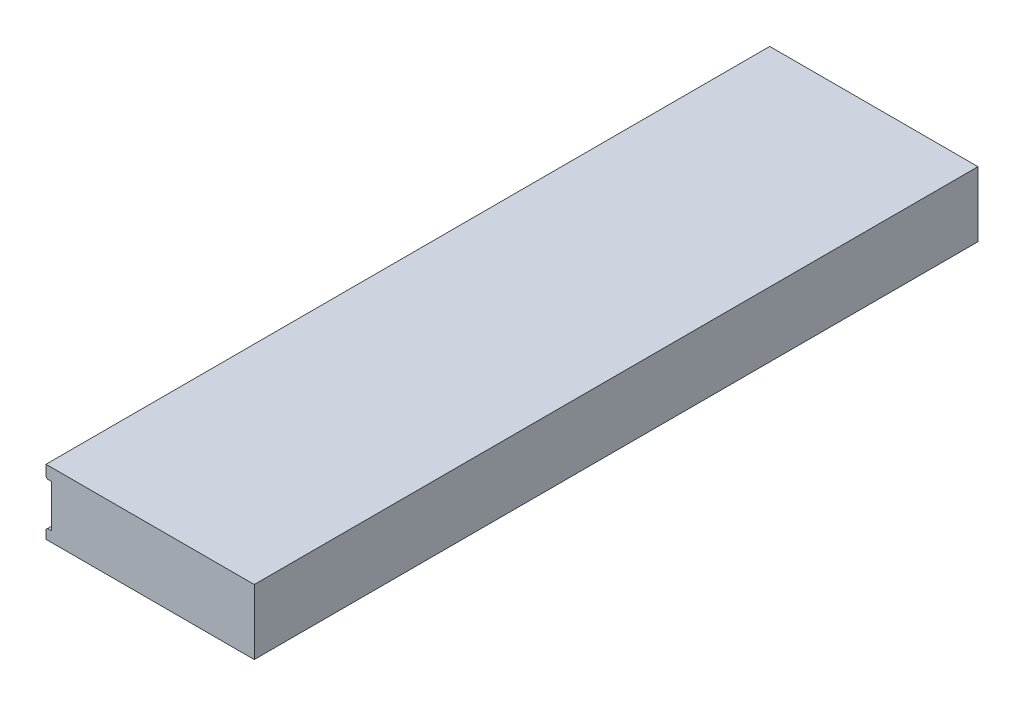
SolidWorks part; units mm, degrees
ref_plane "FRONT" through (0, 0, 0) normal (0, 0, 1) x (1, 0, 0)
ref_plane "TOP" through (0, 0, 0) normal (0, 1, 0) x (1, 0, 0)
ref_plane "RIGHT" through (0, 0, 0) normal (1, 0, 0) x (0, 0, -1)
sketch "Sketch1" plane through (0, 0, 0) normal (0, 0, 1) x (1, 0, 0)
  line L0 (50.673, 0) -> (50.673, -16.256)
  line L1 (50.673, -16.256) -> (-1.397, -16.256)
  line L2 (-1.397, -16.256) -> (-1.397, -13.716)
  line L3 (-1.397, -13.716) -> (0, -13.716)
  line L4 (0, -13.716) -> (0, -3.048)
  line L5 (0, -3.048) -> (-1.397, -3.048)
  line L6 (-1.397, -3.048) -> (-1.397, 0)
  line L7 (-1.397, 0) -> (50.673, 0)
  dimension "D1" = 52.07
  dimension "D2" = 50.673
  dimension "D3" = 3.048
  dimension "D4" = 2.54
  dimension "D5" = 16.256
extrude "Extrude1" add sketch "Sketch1" along normal mid plane 180.9496
sketch "Sketch2" plane through (0, 0, 0) normal (-1, 0, 0) x (0, 0, 1)
  line L1 (0, 0) -> (0, -16.256) construction
  line L2 (90.4748, -16.256) -> (-90.4748, -16.256) construction
  line L3 (0, -8.128) -> (26.0126, -8.128) construction
  point P0 (-85.598, -8.128)
  point P1 (85.598, -8.128)
  point P2 (4.8768, -8.128)
  point P4 (-4.8768, -8.128)
  dimension "D1" = 85.598
  dimension "D2" = 85.598
  dimension "D3" = 4.8768
hole_wizard "#10-32 Tapped Hole1" positions "3DSketch1" profile "Sketch3" tap size "#10-32" standard "Ansi Inch"
sketch3d "3DSketch1"
  point P0 (0, -8.128, -85.598)
  point P3 (0, -8.128, 85.598)
  point P6 (0, -8.128, 4.8768)
  point P9 (0, -8.128, -4.8768)
sketch "Sketch3" plane through (0, -8.128, -85.598) normal (0, 1, 0) x (0, 0, 1)
  line L0 (0, 0) -> (0, 11.2108)
  line L1 (0, 11.2108) -> (2.0193, 9.9974)
  line L2 (2.0193, 9.9974) -> (2.0193, 7.62)
  line L3 (2.0193, 7.62) -> (2.413, 7.62)
  line L4 (2.413, 7.62) -> (2.413, 0)
  line L5 (2.413, 0) -> (0, 0)
  line L10 (0, 11.2108) -> (-2.0193, 9.9974) construction
  line L11 (0, -6.35) -> (0, 107.95) construction
  dimension "Tap Drill Dia." = 4.0386
  dimension "Tap Drill Depth" = 9.9974
  dimension "Thread Major Dia." = 4.826
  dimension "Thread Depth" = 7.62
  dimension "Drill Angle" = 118
chamfer "Chamfer1" distance 0.381 angle 45 2 edges at (-1.397, -13.716, 0) (-1.397, -3.048, 0)
